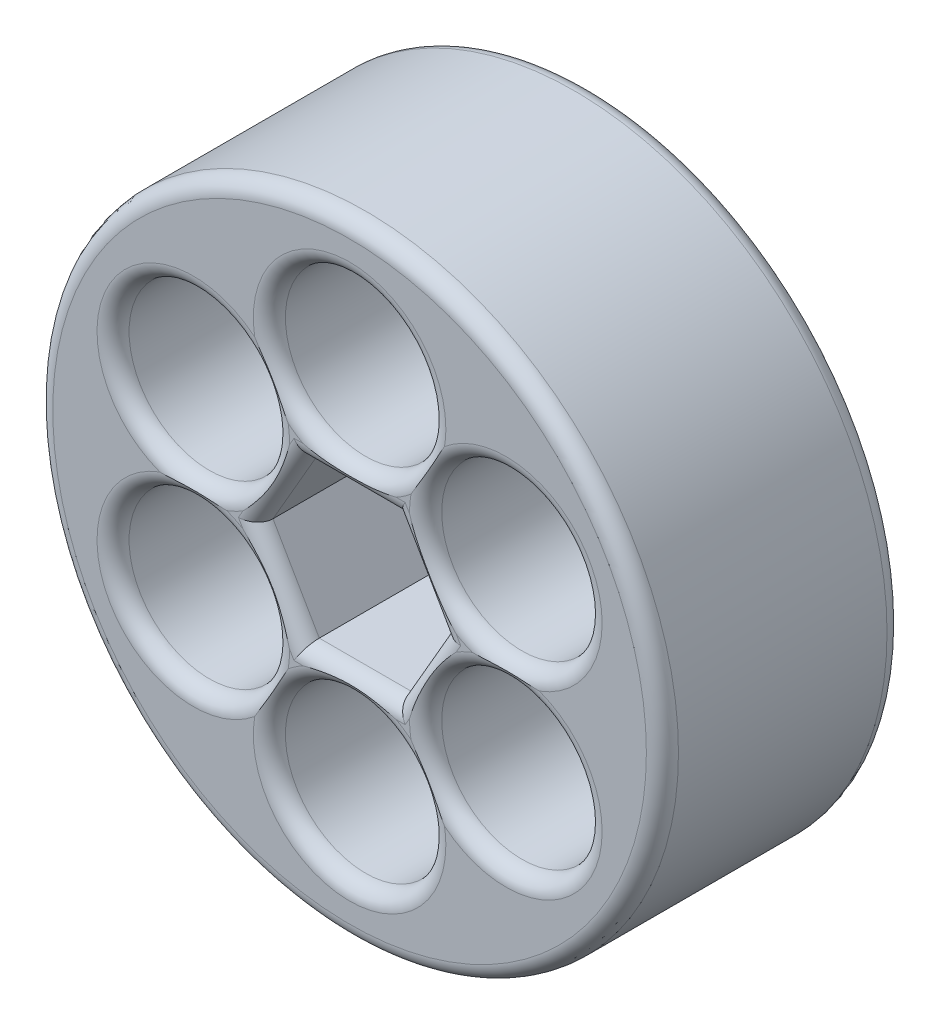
SolidWorks part; units mm, degrees
ref_plane "Plan de face" through (0, 0, 0) normal (0, 0, 1) x (1, 0, 0)
ref_plane "Plan de dessus" through (0, 0, 0) normal (0, 1, 0) x (1, 0, 0)
ref_plane "Plan de droite" through (0, 0, 0) normal (1, 0, 0) x (0, 0, -1)
sketch "Esquisse1" plane through (0, 0, 0) normal (0, 0, 1) x (1, 0, 0)
  circle A0 centre (0, 0) radius 19.5
  dimension "D1" = 39
extrude "Boss.-Extru.1" add sketch "Esquisse1" along normal blind 15
sketch "Esquisse2" plane through (0, 0, 15) normal (0, 0, 1) x (1, 0, 0)
  circle A0 centre (0, 0) radius 3
  dimension "D1" = 6
extrude "Enlèv. mat.-Extru.1" cut sketch "Esquisse2" against normal through all
sketch "Esquisse3" plane through (0, 0, 15) normal (0, 0, 1) x (1, 0, 0)
  line L0 (0, 0) -> (0, 3) construction
  line L1 (0, 3) -> (0, 11.25) construction
  line L2 (0, 11.25) -> (0, 19.5) construction
  circle A0 centre (0, 11.25) radius 5
  circle A1 centre (0, 0) radius 3 construction
  circle A2 centre (0, 0) radius 19.5 construction
  circle A3 centre (9.7428, 5.625) radius 5
  circle A4 centre (9.7428, -5.625) radius 5
  circle A5 centre (0, -11.25) radius 5
  circle A6 centre (-9.7428, -5.625) radius 5
  circle A7 centre (-9.7428, 5.625) radius 5
  point P24 (0, 0)
  dimension "D2" = 10
  dimension "D1" = 6
extrude "Enlèv. mat.-Extru.2" cut sketch "Esquisse3" against normal through all
sketch "Esquisse6" plane through (0, 0, 15) normal (0, 0, 1) x (1, 0, 0)
  line L1 (-2.8868, 5) -> (-5.7735, 0)
  line L2 (-5.7735, 0) -> (-2.8868, -5)
  line L3 (-2.8868, -5) -> (2.8868, -5)
  line L4 (2.8868, -5) -> (5.7735, 0)
  line L5 (5.7735, 0) -> (2.8868, 5)
  line L6 (2.8868, 5) -> (-2.8868, 5)
  circle A1 centre (0, 0) radius 5 construction
  dimension "D2" = 10
extrude "Enlèv. mat.-Extru.3" cut sketch "Esquisse6" against normal blind 8
fillet "Congé1" radius 1 21 edges at (19.5, 0, 0) (3, 0, 0) (5, 11.25, 0) (-4.7428, 5.625, 0) (14.7428, 5.625, 0) (14.7428, -5.625, 0) (-4.7428, -5.625, 0) (5, -11.25, 0) (19.5, 0, 15) (5, 11.25, 15) (-4.7428, 5.625, 15) (14.7428, 5.625, 15) (14.7428, -5.625, 15) (-4.7428, -5.625, 15) (5, -11.25, 15) (-4.3301, 2.5, 15) (-4.3301, -2.5, 15) (0, -5, 15) (4.3301, -2.5, 15) (4.3301, 2.5, 15) (0, 5, 15)
